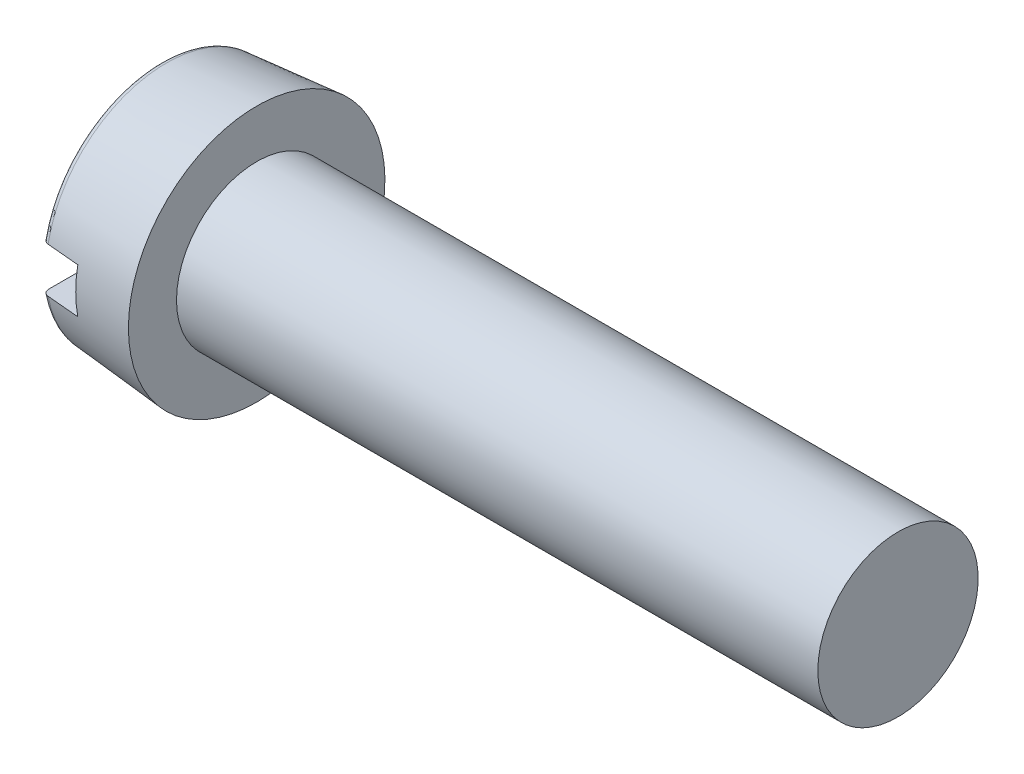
SolidWorks part; units mm, degrees
ref_plane "Front Plane" through (0, 0, 0) normal (0, 0, 1) x (1, 0, 0)
ref_plane "Top Plane" through (0, 0, 0) normal (0, 1, 0) x (1, 0, 0)
ref_plane "Right Plane" through (0, 0, 0) normal (1, 0, 0) x (0, 0, -1)
other "Configuration Table"
sketch "BodySke" plane through (0, 0, 0) normal (0, 0, 1) x (1, 0, 0)
  line L0 (0, 0) -> (111.3824, 0) construction
  line L1 (0, 0) -> (0, 7.4751)
  line L2 (0, 7.4751) -> (6, 8)
  line L3 (6, 8) -> (6, 5)
  line L4 (6, 5) -> (46, 5)
  line L5 (46, 5) -> (46, 0)
  line L6 (7.5, 8.824) -> (7.5, -5.8939) construction
  line L7 (0, 0) -> (46, 0)
  line L8 (9, 8.824) -> (9, -4.958) construction
  point P10 (46, 4.172)
revolve "BaseBody" add sketch "BodySke" angle 360 about L0
fillet "Fillet1" radius 0.4 1 edges at (0, 0, 7.4751)
sketch "SlotSke" plane through (0, 0, 0) normal (-1, 0, 0) x (0, 0, 1)
  line L1 (-8, 1.405) -> (8, 1.405)
  line L2 (-8, 1.405) -> (-8, -1.405)
  line L3 (-8, -1.405) -> (8, -1.405)
  line L4 (8, 1.405) -> (8, -1.405)
extrude "Slot" cut sketch "SlotSke" against normal blind 2.4
sketch "ThdSchSke" plane through (0, 0, 0) normal (0, 0, 1) x (1, 0, 0)
  line L0 (0, 0) -> (55.1256, 0) construction
  line L1 (0, 0) -> (111.3824, 0) construction
  line L2 (45.522, 5) -> (45.522, 5.9561)
  line L3 (45.522, 5.9561) -> (46.478, 5.9561)
  line L4 (46.478, 5.9561) -> (46.478, 5)
  line L5 (46.478, 5) -> (46, 4.172)
  line L6 (46, 4.172) -> (45.522, 5)
  line L7 (6, 5) -> (46, 5) construction
  line L13 (46, 5) -> (46, 0) construction
revolve "ThreadSchematic" [suppressed] cut sketch "ThdSchSke" angle 360 about L0
pattern_linear "ThdSchPat" [suppressed] count 25 along (1, 0, 0)
equation "\"Thread_minor@ThreadCosmetic\" = \"Thread_minor@BodySke\""
equation "\"D1@SlotSke\" = \"Head_dia@BodySke\""
equation "\"D2@SlotSke\" = \"D1@SlotSke\" / 2"
equation "\"D3@SlotSke\" = \"Slot_width@SlotSke\" / 2"
equation "\"Advance@ThdSchPat\" = \"Advance@BodySke\""
equation "\"D1@ThdSchPat\" =  int(  ( \"Length@BodySke\" - \"Thread_runout@BodySke\" )  / \"Advance@ThdSchPat\" )  + 1"
